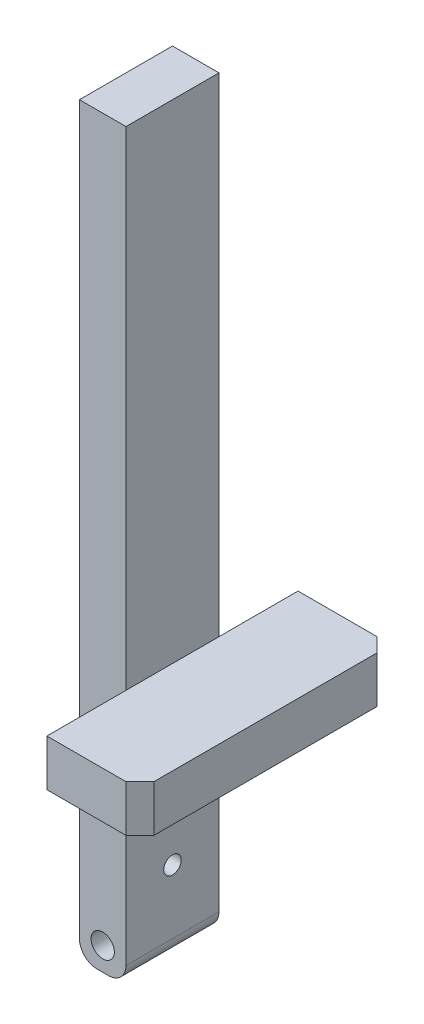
SolidWorks part; units mm, degrees
ref_plane "Front Plane" through (0, 0, 0) normal (0, 0, 1) x (1, 0, 0)
ref_plane "Top Plane" through (0, 0, 0) normal (0, 1, 0) x (1, 0, 0)
ref_plane "Right Plane" through (0, 0, 0) normal (1, 0, 0) x (0, 0, -1)
sketch "Sketch1" plane through (0, 0, 0) normal (0, 0, 1) x (1, 0, 0)
  line L0 (-6.35, -6.35) -> (6.35, -6.35)
  line L1 (6.35, -6.35) -> (6.35, 196.85)
  line L2 (6.35, 196.85) -> (-6.35, 196.85)
  line L3 (-6.35, 196.85) -> (-6.35, -6.35)
  line L4 (0, 0) -> (0, 11.1705) construction
  line L5 (6.35, 50.8) -> (31.75, 50.8)
  line L6 (31.75, 50.8) -> (31.75, 63.5)
  line L7 (31.75, 63.5) -> (6.35, 63.5)
  line L8 (31.75, 57.15) -> (8.9522, 57.15) construction
  circle A0 centre (0, 0) radius 3.175
  dimension "D1" = 6.35
  dimension "D2" = 12.7
  dimension "D3" = 6.35
  dimension "D4" = 203.2
  dimension "D5" = 57.15
  dimension "D6" = 12.7
  dimension "D7" = 25.4
sketch "Sketch2" plane through (0, 0, 0) normal (0, 0, 1) x (1, 0, 0)
  line L0 (6.35, -6.35) -> (6.35, 196.85) construction
  line L1 (6.35, 196.85) -> (-6.35, 196.85) construction
  line L2 (-6.35, 196.85) -> (-6.35, -6.35) construction
  line L3 (-6.35, -6.35) -> (6.35, -6.35) construction
  line L4 (6.35, -6.35) -> (6.35, 196.85)
  line L5 (6.35, 196.85) -> (-6.35, 196.85)
  line L6 (-6.35, 196.85) -> (-6.35, -6.35)
  line L7 (-6.35, -6.35) -> (6.35, -6.35)
  circle A0 centre (0, 0) radius 3.175 construction
  circle A1 centre (0, 0) radius 3.175
extrude "Boss-Extrude1" add sketch "Sketch2" along normal mid plane 25.4
sketch "Sketch3" plane through (0, 0, 0) normal (0, 0, 1) x (1, 0, 0)
  line L1 (31.75, 50.8) -> (31.75, 63.5) construction
  line L3 (6.35, 50.8) -> (31.75, 50.8) construction
  line L4 (31.75, 63.5) -> (6.35, 63.5) construction
  line L5 (31.75, 50.8) -> (31.75, 63.5)
  line L6 (6.35, -6.35) -> (6.35, 196.85) construction
  line L7 (6.35, 50.8) -> (31.75, 50.8)
  line L9 (31.75, 63.5) -> (6.35, 63.5)
  line L10 (6.35, 50.8) -> (6.35, 63.5)
extrude "Boss-Extrude2" add sketch "Sketch3" along normal mid plane 68.58 separate body
sketch "Sketch6" plane through (0, 0, 0) normal (1, 0, 0) x (0, 0, -1)
  line L0 (0, 0) -> (0, 30.8635) construction
  line L1 (-34.29, 50.8) -> (34.29, 50.8) construction
  circle A0 centre (-6.35, 57.15) radius 2.3876
  circle A1 centre (6.35, 57.15) radius 2.3876
  dimension "D1" = 4.7752
  dimension "D2" = 6.35
  dimension "D3" = 12.7
extrude "Cut-Extrude2" cut sketch "Sketch6" against normal blind 15.24 and the other way blind 17.78
chamfer "Chamfer1" distance 3.81 angle 45 2 edges at (31.75, 57.15, -34.29) (31.75, 57.15, 34.29)
fillet "Fillet1" radius 4.7752 2 edges at (-6.35, -6.35, 0) (6.35, -6.35, 0)
sketch "Sketch8" plane through (0, 0, 0) normal (1, 0, 0) x (0, 0, -1)
  circle A0 centre (0, 15.875) radius 2.3876
  circle A1 centre (0, 41.275) radius 2.3876
  dimension "D3" = 4.7752
  dimension "D1" = 15.875
  dimension "D2" = 25.4
extrude "Cut-Extrude3" cut sketch "Sketch8" against normal mid plane 25.4
